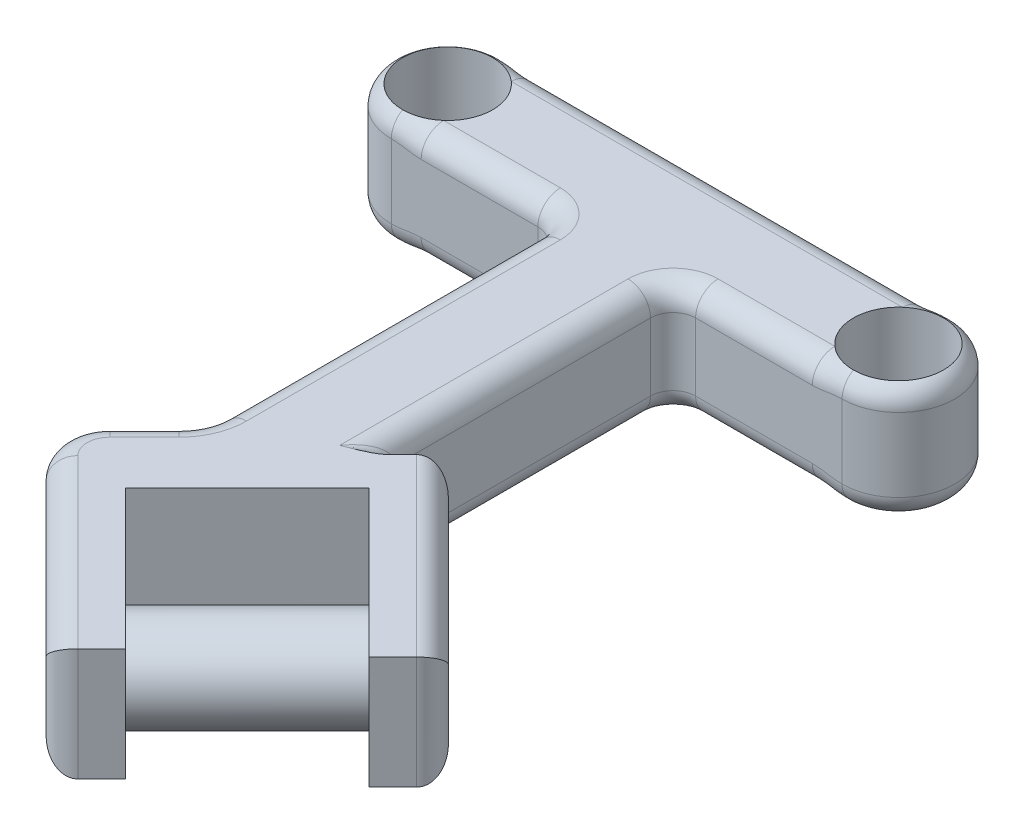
SolidWorks part; units mm, degrees
ref_plane "Piano frontale" through (0, 0, 0) normal (0, 0, 1) x (1, 0, 0)
ref_plane "Piano superiore" through (0, 0, 0) normal (0, 1, 0) x (1, 0, 0)
ref_plane "Piano destro" through (0, 0, 0) normal (1, 0, 0) x (0, 0, -1)
sketch "Schizzo1" plane through (0, 0, 0) normal (0, 0, 1) x (1, 0, 0)
  line L0 (735.219, -95.552) -> (735.219, 219.448)
  line L1 (735.219, 219.448) -> (664.5083, 290.1587)
  line L2 (585.219, -145.552) -> (985.219, -145.552) construction
  line L3 (585.219, -145.552) -> (985.219, -145.552) construction
  line L4 (585.219, -95.552) -> (735.219, -95.552)
  line L5 (585.219, -195.552) -> (985.219, -195.552)
  line L6 (664.5083, 290.1587) -> (841.285, 466.9354)
  line L7 (841.285, 466.9354) -> (876.6404, 431.5801)
  line L8 (876.6404, 431.5801) -> (752.8967, 307.8364)
  line L9 (752.8967, 307.8364) -> (860.752, 199.9811)
  line L10 (860.752, 199.9811) -> (990.7825, 330.0115)
  line L11 (990.7825, 330.0115) -> (1026.1378, 294.6562)
  line L12 (1026.1378, 294.6562) -> (870.5743, 139.0927)
  line L13 (870.5743, 139.0927) -> (835.219, 174.448)
  line L14 (835.219, 174.448) -> (835.219, -95.552)
  line L15 (835.219, -95.552) -> (985.219, -95.552)
  line L16 (835.219, 174.448) -> (735.219, 174.448) construction
  arc A0 (585.219, -95.552) -> (585.219, -195.552) centre (585.219, -145.552) ccw
  arc A1 (985.219, -195.552) -> (985.219, -95.552) centre (985.219, -145.552) ccw
  point P7 (485.219, -95.552)
  point P18 (1035.219, -145.552)
  dimension "D1" = 50
  dimension "D2" = 400
  dimension "D3" = 100
  dimension "D4" = 150
  dimension "D5" = 135
  dimension "D6" = 45
  dimension "D7" = 50
  dimension "D8" = 50
  dimension "D9" = 75
  dimension "D10" = 250
  dimension "D11" = 220
  dimension "D12" = 50
  dimension "D13" = 100
  dimension "D14" = 270
  dimension "D15" = 315
  dimension "D16" = 100
  dimension "D17" = 50
extrude "Estrusione-Estrusione1" add sketch "Schizzo1" along normal blind 100
sketch "Schizzo2" plane through (0, 0, 100) normal (0, 0, 1) x (1, 0, 0)
  line L0 (535.219, -145.552) -> (1035.219, -145.552) construction
  line L1 (585.219, -95.552) -> (585.219, -195.552) construction
  line L2 (985.219, -95.552) -> (985.219, -195.552) construction
  arc A0 (585.219, -95.552) -> (585.219, -195.552) centre (585.219, -145.552) ccw construction
  arc A1 (985.219, -195.552) -> (985.219, -95.552) centre (985.219, -145.552) ccw construction
  circle A2 centre (585.219, -145.552) radius 40
  circle A3 centre (985.219, -145.552) radius 40
  dimension "D1" = 80
  dimension "D2" = 80
extrude "Taglio-Estrusione1" cut sketch "Schizzo2" against normal blind 100
sketch "Schizzo3" plane through (187.1748, -187.1748, 0) normal (-0.7071, 0.7071, 0) x (0, 0, 1)
  line L0 (50, 925.0515) -> (50, 675.0515) construction
  line L1 (100, 925.0515) -> (0, 925.0515) construction
  line L2 (100, 675.0515) -> (0, 675.0515) construction
  line L3 (0, 875.0515) -> (100, 875.0515) construction
  line L6 (0, 925.0515) -> (0, 675.0515) construction
  line L7 (100, 925.0515) -> (100, 675.0515) construction
  circle A1 centre (50, 875.0515) radius 39.5
  dimension "D1" = 79
  dimension "D2" = 50
extrude "Estrusione-Estrusione2" add sketch "Schizzo3" against normal up to vertex
move or copy body "Corpo-Sposta/copia1" bodies to move or copy 109 copy no rotation origin (0, 198.5506, 50) rotation axis (1, 0, 0) rotation angle 90
fillet "Raccordo1" radius 20 1 edges at (735.219, 198.5506, -244.1025)
fillet "Raccordo2" radius 20 1 edges at (835.219, 198.5506, -244.1025)
fillet "Raccordo3" radius 40 1 edges at (735.219, 198.5506, 70.8975)
fillet "Raccordo4" radius 40 1 edges at (664.5083, 198.5506, 141.6081)
fillet "Raccordo5" radius 20 27 edges at (835.219, 148.5506, -99.1025) (841.0769, 148.5506, -238.2447) (920.219, 148.5506, -244.1025) (785.219, 148.5506, -344.1025) (650.219, 148.5506, -244.1025) (729.3611, 148.5506, -238.2447) (735.219, 148.5506, -84.8868) (732.1742, 148.5506, 69.6363) (708.1479, 148.5506, 97.9685) (681.0769, 148.5506, 141.6081) (835.219, 248.5506, -99.1025) (841.0769, 248.5506, -238.2447) (920.219, 248.5506, -244.1025) (785.219, 248.5506, -344.1025) (650.219, 248.5506, -244.1025) (729.3611, 248.5506, -238.2447) (735.219, 248.5506, -84.8868) (732.1742, 248.5506, 69.6363) (708.1479, 248.5506, 97.9685) (681.0769, 248.5506, 141.6081) (841.285, 198.5506, 318.3848) (767.0388, 148.5506, 244.1386) (767.0388, 248.5506, 244.1386) (870.5743, 198.5506, -9.4579) (948.3561, 148.5506, 68.3239) (1026.1378, 198.5506, 146.1056) (948.3561, 248.5506, 68.3239)
fillet "Raccordo6" radius 10 3 edges at (829.3611, 154.4085, 31.7553) (829.3611, 242.6927, 31.7553) (835.219, 198.5506, 25.8975)
